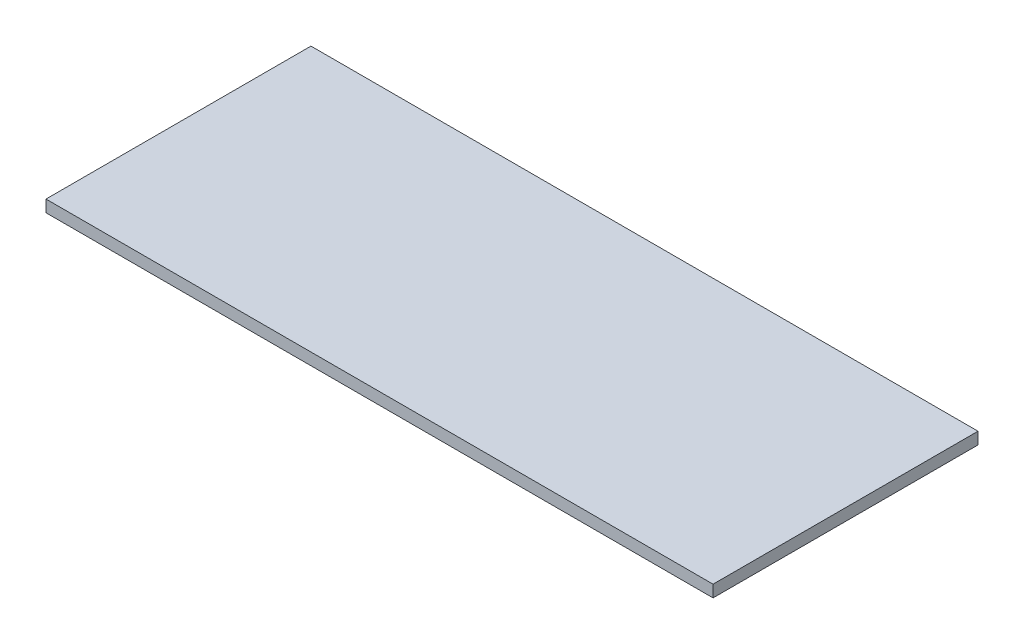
SolidWorks part; units mm, degrees
ref_plane "Front Plane" through (0, 0, 0) normal (0, 0, 1) x (1, 0, 0)
ref_plane "Top Plane" through (0, 0, 0) normal (0, 1, 0) x (1, 0, 0)
ref_plane "Right Plane" through (0, 0, 0) normal (1, 0, 0) x (0, 0, -1)
sketch "Sketch1" plane through (0, 0, 0) normal (0, 1, 0) x (1, 0, 0)
  line L1 (-46.2, 18.35) -> (46.2, 18.35)
  line L2 (-46.2, 18.35) -> (-46.2, -18.35)
  line L3 (-46.2, -18.35) -> (46.2, -18.35)
  line L4 (46.2, 18.35) -> (46.2, -18.35)
  line L5 (-46.2, 18.35) -> (46.2, -18.35) construction
  line L6 (-46.2, -18.35) -> (46.2, 18.35) construction
  point P0 (0, 0)
  dimension "D1" = 92.4
  dimension "D2" = 36.7
extrude "Boss-Extrude1" add sketch "Sketch1" along normal blind 1.65
sketch "Sketch2" plane through (0, 0, 0) normal (0, -1, 0) x (1, 0, 0)
  line L0 (46.2, -18.35) -> (-46.2, -18.35) construction
  line L1 (-44.1, -18.35) -> (-42.6, -18.35)
  line L2 (-44.1, -18.35) -> (-44.1, 18.35)
  line L3 (-44.1, 18.35) -> (-42.6, 18.35)
  line L4 (-42.6, -18.35) -> (-42.6, 18.35)
  line L5 (-46.2, -18.35) -> (-46.2, 18.35) construction
  line L6 (-46.2, 18.35) -> (46.2, 18.35) construction
  dimension "D1" = 2.1
  dimension "D2" = 1.5
  dimension "D3" = 0
extrude "Boss-Extrude2" add sketch "Sketch2" along normal blind 0.4
chamfer "Chamfer1" distance 0.4 angle 75 2 edges at (-42.6, -0.4, 0) (-44.1, -0.4, 0)
sketch "Sketch4" plane through (0, 0, 0) normal (0, -1, 0) x (1, 0, 0)
  line L1 (-46.2, 18.35) -> (-38.7525, 18.35)
  line L2 (-46.2, 18.35) -> (-46.2, 17.35)
  line L3 (-46.2, 17.35) -> (-38.7525, 17.35)
  line L4 (-38.7525, 18.35) -> (-38.7525, 17.35)
  line L5 (-46.2, -18.35) -> (-40.5858, -18.35)
  line L6 (-46.2, -18.35) -> (-46.2, -17.35)
  line L7 (-46.2, -17.35) -> (-40.5858, -17.35)
  line L8 (-40.5858, -18.35) -> (-40.5858, -17.35)
  dimension "D1" = 1
  dimension "D2" = 1
extrude "Cut-Extrude2" cut sketch "Sketch4" along normal through all
sketch "Sketch3" [suppressed] plane through (0, 1.65, 0) normal (0, 1, 0) x (1, 0, 0)
  line L0 (-46.2, 18.35) -> (-46.2, -18.35) construction
  line L1 (72.8469, 24.0548) -> (-8.8, 24.0548)
  line L2 (72.8469, 24.0548) -> (72.8469, -27.0371)
  line L3 (72.8469, -27.0371) -> (-8.8, -27.0371)
  line L4 (-8.8, 24.0548) -> (-8.8, -27.0371)
  dimension "D1" = 37.4
extrude "Cut-Extrude1" [suppressed] cut sketch "Sketch3" against normal through all
fillet "Fillet1" radius 1 3 edges at (-43.35, -0.201, 0) (-42.6, 0, 0) (-44.1, 0, 0)
